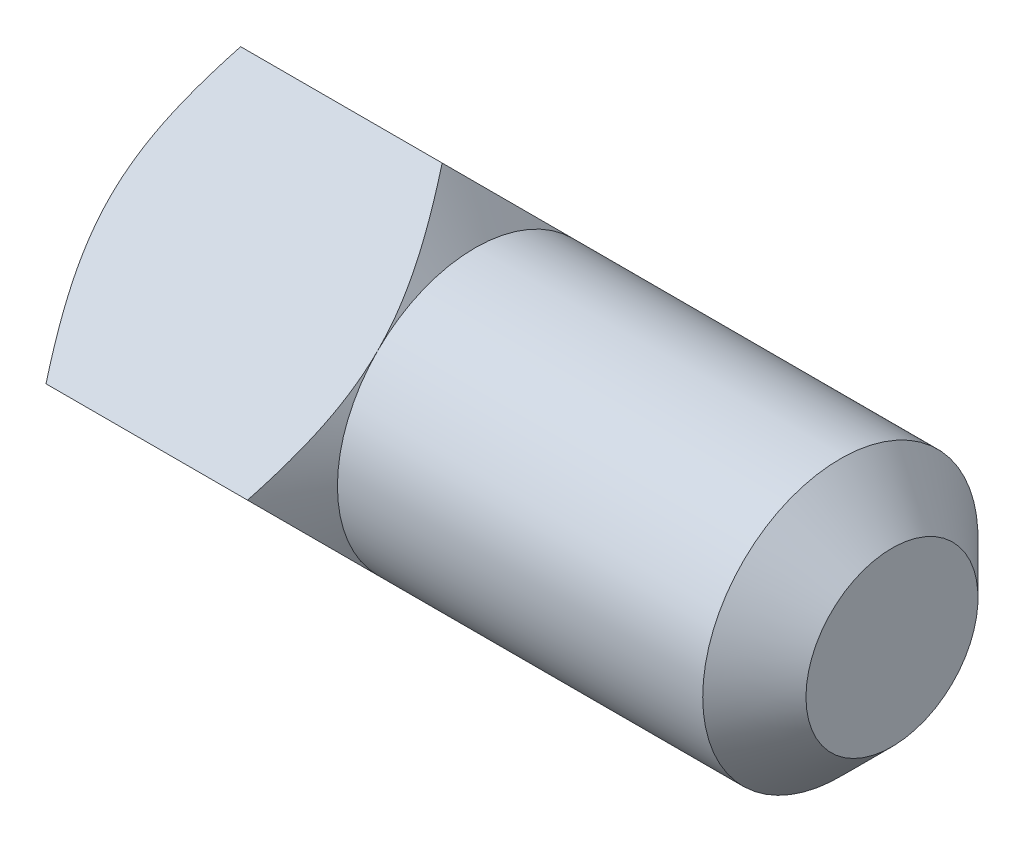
SolidWorks part; units mm, degrees
ref_plane "Front Plane" through (0, 0, 0) normal (0, 0, 1) x (1, 0, 0)
ref_plane "Top Plane" through (0, 0, 0) normal (0, 1, 0) x (1, 0, 0)
ref_plane "Right Plane" through (0, 0, 0) normal (1, 0, 0) x (0, 0, -1)
sketch "BaseHeadSke" plane through (0, 0, 0) normal (1, 0, 0) x (0, 0, -1)
  line L0 (0, 0) -> (14.1701, 0) construction
  line L1 (0, 0) -> (0, 11.9761) construction
  line L2 (0, 2.8284) -> (2.8284, 0)
  line L3 (0, -2.8284) -> (2.8284, 0)
  line L4 (0, 2.8284) -> (-2.8284, 0)
  line L5 (0, -2.8284) -> (-2.8284, 0)
  dimension "Width_flats" = 4
  dimension "Angle" = 45
extrude "BaseHead" add sketch "BaseHeadSke" along normal blind 4
sketch "HeadChamferSke" plane through (0, 0, 0) normal (0, 0, 1) x (1, 0, 0)
  line L0 (0, 0) -> (6.1973, 0) construction
  line L1 (2, 2.8284) -> (2, -3.5627) construction
  line L2 (4, 2.8284) -> (0, 2.8284) construction
  line L3 (0, 2.8284) -> (0, 1.9)
  line L4 (0, 2.8284) -> (0.536, 2.8284)
  line L5 (0.536, 2.8284) -> (0, 1.9)
  line L6 (0, 2.8284) -> (0, 0) construction
  line L7 (3.464, 2.8284) -> (4, 1.9)
  line L8 (4, 2.8284) -> (3.464, 2.8284)
  line L9 (4, 2.8284) -> (4, 1.9)
  dimension "Head_chamfer" = 3.8
  dimension "Angle" = 30
revolve "HeadChamfer" cut sketch "HeadChamferSke" angle 360 about L0
sketch "BodySke" plane through (0, 0, 0) normal (0, 0, 1) x (1, 0, 0)
  line L0 (0, 0) -> (13.1857, 0) construction
  line L1 (4, -1.9) -> (4, 1.9) construction
  line L2 (4, 0) -> (4, 1.9) construction
  line L3 (3.464, 2) -> (10, 2)
  line L4 (10, 2) -> (10, 0)
  line L5 (4, 1.9) -> (4, 2) construction
  line L6 (3.464, 2) -> (3.464, 0)
  line L7 (3.464, 0) -> (10, 0)
  line L8 (9.65, -0.6243) -> (9.65, 3.2323) construction
  point P9 (3.464, 1.61)
  dimension "Diameter" = 4
  dimension "Length" = 6
  dimension "Minor_dia" = 3.22
  dimension "Advance" = 0.7
revolve "BaseBody" add sketch "BodySke" angle 360 about L0
sketch "ChamferEndSke" plane through (0, 0, 0) normal (0, 0, 1) x (1, 0, 0)
  line L0 (0, 0) -> (11.9528, 0) construction
  line L1 (10, 2) -> (10, 1.25)
  line L2 (10, 1.25) -> (9.25, 2)
  line L3 (9.25, 2) -> (10, 2)
  line L4 (10, 2) -> (3.9423, 2) construction
  line L5 (10, -2) -> (10, 2) construction
  dimension "D1" = 45
  dimension "End_chamfer" = 2.5
revolve "ChamferEnd" cut sketch "ChamferEndSke" angle 360 about L0
sketch "ThdSchSke" plane through (0, 0, 0) normal (0, 0, 1) x (1, 0, 0)
  line L0 (8.55, 2.4503) -> (8.55, 2)
  line L1 (8.55, 2.4503) -> (9.0003, 2.4503)
  line L2 (9.0003, 2.4503) -> (9.0003, 2)
  line L3 (9.0003, 2) -> (8.7752, 1.61)
  line L4 (8.7752, 1.61) -> (8.55, 2)
  line L5 (0, 0) -> (11.8711, 0) construction
  line L6 (9.25, 2) -> (3.9423, 2) construction
  dimension "D1" = 0.7
revolve "ThreadSchematic" [suppressed] cut sketch "ThdSchSke" angle 360 about L5
pattern_linear "ThdSchPat" [suppressed] count 6
equation "\"Minor_dia@ThreadCosmetic\" = \"Minor_dia@BodySke\""
equation "\"D1@ThdSchSke\" = \"Advance@BodySke\""
equation "\"Advance@ThdSchPat\" = \"Advance@BodySke\""
equation "\"D1@ThdSchPat\" =  int( (  \"Length@BodySke\" -  ( \"Diameter@BodySke\" - \"End_chamfer@ChamferEndSke\" )  / 2 )  / \"Advance@ThdSchPat\" )  - 1"
